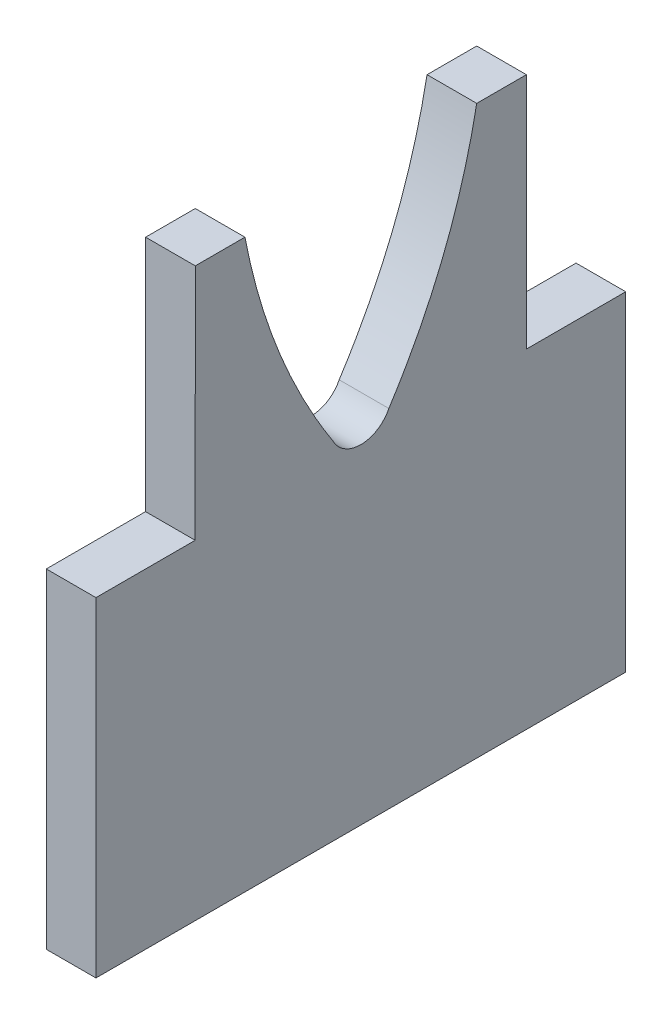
SolidWorks part; units mm, degrees
ref_plane "Front Plane" through (0, 0, 0) normal (0, 0, 1) x (1, 0, 0)
ref_plane "Top Plane" through (0, 0, 0) normal (0, 1, 0) x (1, 0, 0)
ref_plane "Right Plane" through (0, 0, 0) normal (1, 0, 0) x (0, 0, -1)
sketch "Sketch1" plane through (0, 0, 0) normal (0, 0, 1) x (1, 0, 0)
  line L0 (196.7783, 47.5295) -> (199.7783, 47.5295)
  line L1 (199.7783, 47.5295) -> (199.7783, 27.6308)
  line L2 (199.7783, 27.6308) -> (196.7783, 27.6308)
  line L3 (196.7783, 27.6308) -> (196.7783, 47.5295)
extrude "Boss-Extrude1" add sketch "Sketch1" against normal blind 32
sketch "Sketch2" plane through (196.7783, 0, 0) normal (-1, 0, 0) x (0, 0, 1)
  line L0 (-26.0038, 47.5295) -> (-26, 61.8844)
  line L1 (-32, 47.5295) -> (0, 47.5295) construction
  line L2 (-16, 47.5295) -> (-16, 51.3094) construction
  line L3 (-26, 61.8844) -> (-23, 61.8844)
  line L4 (-5.9962, 47.5295) -> (-6, 61.8844)
  line L5 (-6, 61.8844) -> (-9, 61.8844)
  line L6 (-26.0038, 47.5295) -> (-5.9962, 47.5295)
  arc A0 (-17.6923, 48.578) -> (-14.3077, 48.578) centre (-16, 49.4195) ccw
  spline S0 degree 2 poles (-23, 61.8844) (-21.6265, 54.6712) (-17.6923, 48.578) knots 0 0 0 1 1 1
  spline S1 degree 2 poles (-9, 61.8844) (-10.3735, 54.6712) (-14.3077, 48.578) knots 0 0 0 1 1 1
extrude "Boss-Extrude2" add sketch "Sketch2" against normal blind 3 contours L5 S1 A0 L4 M2 | S0 L3 L0 L6 A0
